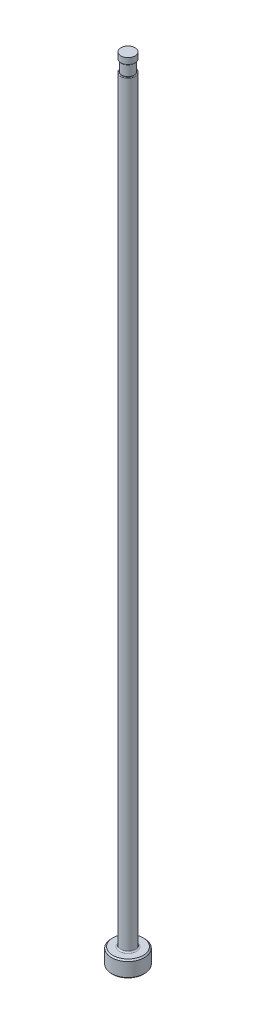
SolidWorks part; units mm, degrees
ref_plane "Front Plane" through (0, 0, 0) normal (0, 0, 1) x (1, 0, 0)
ref_plane "Top Plane" through (0, 0, 0) normal (0, 1, 0) x (1, 0, 0)
ref_plane "Right Plane" through (0, 0, 0) normal (1, 0, 0) x (0, 0, -1)
other "Configuration Table"
sketch "Sketch1" plane through (0, 0, 0) normal (0, 0, 1) x (1, 0, 0)
  line L0 (0, 259.9588) -> (0, -15.1925) construction
  line L1 (0, 0) -> (-3.175, 0)
  line L2 (-3.175, 0) -> (-3.175, 3.175)
  line L3 (-3.175, 3.175) -> (-1.3881, 3.175)
  line L4 (-1.3881, 3.175) -> (-1.3881, 152.4)
  line L5 (-1.3881, 152.4) -> (0, 152.4)
  line L6 (0, 152.4) -> (0, 0)
  dimension "L" = 152.4
  dimension "H" = 6.35
  dimension "T" = 3.175
  dimension "D" = 2.7762
revolve "Revolve1" add sketch "Sketch1" angle 360 about L0
chamfer "Chamfer1" distance 0.254 angle 45 2 edges at (0, 3.175, 3.175) (0, 0, 3.175)
fillet "Fillet1" radius 0.254 1 edges at (0, 3.175, 1.3881)
sketch "Sketch2" plane through (0, 0, 0) normal (0, 0, 1) x (1, 0, 0)
  line L0 (-1.3881, 152.4) -> (-1.3881, 3.429) construction
  line L1 (-1.3881, 151.13) -> (-1.1849, 151.13)
  line L2 (-1.3881, 151.13) -> (-1.3881, 149.098)
  line L3 (-1.3881, 149.098) -> (-1.1849, 149.098)
  line L4 (-1.1849, 151.13) -> (-1.1849, 149.098)
  line L5 (1.3881, 152.4) -> (-1.3881, 152.4) construction
  line L6 (0, 153.4483) -> (0, 147.3282) construction
  dimension "D1" = 2.032
  dimension "N" = 1.27
  dimension "FD" = 0.2032
  dimension "D3" = 2.3698
revolve "Vent Relief" cut sketch "Sketch2" angle 360 about L6
sketch "Sketch3" plane through (0, 0, 0) normal (0, 0, 1) x (1, 0, 0)
  line L0 (-1.1849, 150.114) -> (-1.1849, 86.614)
  line L1 (-1.1849, 151.13) -> (-1.1849, 149.098) construction
  line L2 (-1.3881, 149.098) -> (-1.3881, 3.429) construction
  line L3 (-1.3881, 85.4964) -> (-1.3881, 150.114)
  line L4 (-1.3881, 150.114) -> (-1.1849, 150.114)
  arc A0 (-1.1849, 86.614) -> (-1.3881, 85.4964) centre (-4.3599, 86.614) cw
  dimension "D1" = 3.175
  dimension "D2" = 63.5
extrude "D-Slot" cut sketch "Sketch3" against normal through all both and the other way through all
sketch "Sketch5" plane through (0, 0, 0) normal (0, 0, 1) x (1, 0, 0)
  line L0 (-1.3881, 151.13) -> (1.3881, 151.13) construction
  line L1 (-1.3881, 152.4) -> (-1.3691, 152.4)
  line L2 (-1.3881, 152.4) -> (-1.3881, 151.13)
  line L3 (-1.3881, 151.13) -> (-1.3691, 151.13)
  line L4 (-1.3691, 152.4) -> (-1.3691, 151.13)
  line L5 (0, 152.6877) -> (0, 150.5771) construction
  dimension "VP" = 0.019
revolve "Vent Diameter" cut sketch "Sketch5" angle 360 about L5
fillet "Fillet2" radius 0.127 2 edges at (1.3881, 149.098, 0) (0, 151.13, 1.3691)
sketch "Pocket Sketch" plane through (0, 0, 0) normal (0, 0, 1) x (1, 0, 0)
  line L0 (-3.5719, 0) -> (-3.5719, 3.2004)
  line L1 (-3.5719, 3.2004) -> (-2.3485, 3.2004)
  line L2 (-1.5865, 3.9624) -> (-1.5865, 22.225)
  line L3 (-1.5865, 22.225) -> (0, 22.225)
  line L4 (0, 22.225) -> (0, 0)
  line L5 (0, 0) -> (-3.5719, 0)
  line L6 (0, 12.6104) -> (0, -2.4989) construction
  line L7 (-3.175, 2.921) -> (-3.175, 0.254) construction
  line L8 (2.921, 3.175) -> (-2.921, 3.175) construction
  line L9 (-1.3881, 85.4964) -> (-1.3881, 3.429) construction
  line L10 (-2.3485, 3.2004) -> (-1.5865, 3.9624)
  point P3 (-1.5865, 3.2004)
  dimension "D1" = 7.1437
  dimension "D2" = 0.3969
  dimension "D3" = 0.0254
  dimension "D4" = 0.1984
  dimension "D5" = 3.1731
  dimension "D6" = 22.225
